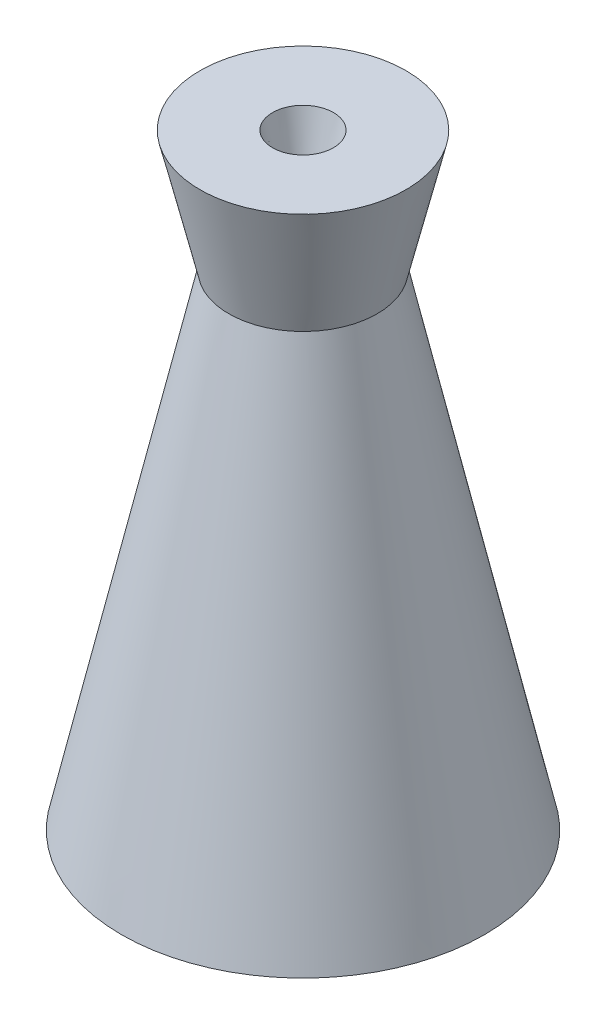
SolidWorks part; units mm, degrees
ref_plane "Front Plane" through (0, 0, 0) normal (0, 0, 1) x (1, 0, 0)
ref_plane "Top Plane" through (0, 0, 0) normal (0, 1, 0) x (1, 0, 0)
ref_plane "Right Plane" through (0, 0, 0) normal (1, 0, 0) x (0, 0, -1)
sketch "Sketch1" plane through (0, 0, 0) normal (0, 0, 1) x (1, 0, 0)
  line L0 (23.495, 0) -> (38.1, 0)
  line L1 (38.1, 0) -> (15.5739, 101.5995)
  line L3 (0.3339, 101.5995) -> (23.495, 0)
  line L4 (0, 0) -> (0, 127) construction
  line L5 (0.3339, 101.5995) -> (6.3966, 127.1923)
  line L6 (6.3966, 127.1923) -> (21.6366, 127.1923)
  line L7 (21.6366, 127.1923) -> (15.5739, 101.5995)
  point P8 (28.2022, 127)
  point P9 (12.2845, 127)
  point P11 (0, 0)
  point P12 (0.2504, 76.1996)
  dimension "D1" = 127
  dimension "D2" = 23.495
  dimension "D3" = 38.1
  dimension "D4" = 15.24
  dimension "D5" = 101.6
revolve "Revolve2" add sketch "Sketch1" angle 360 about L4
